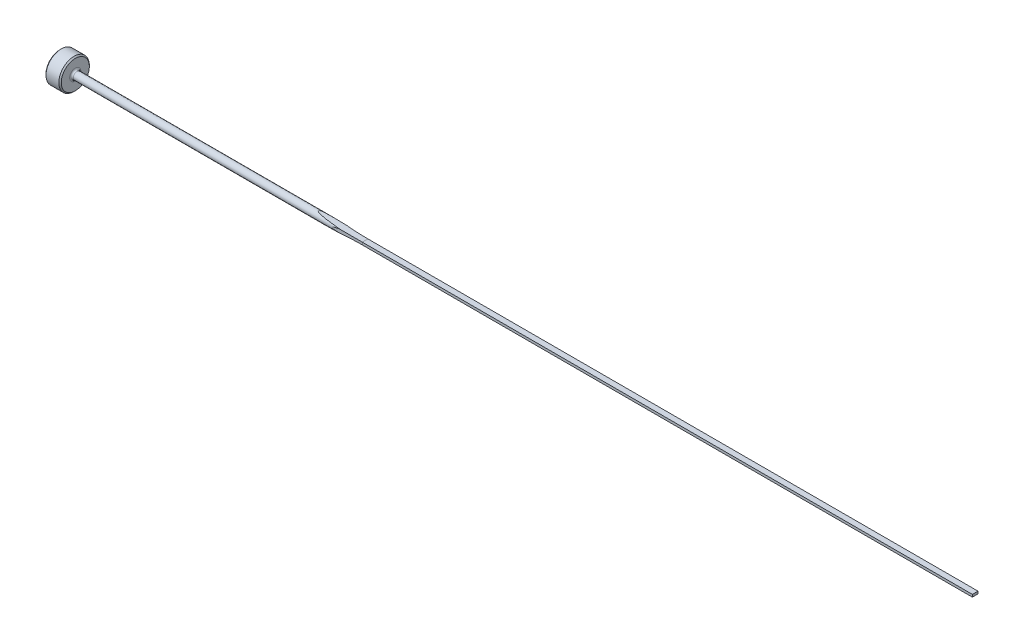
SolidWorks part; units mm, degrees
ref_plane "Front Plane" through (0, 0, 0) normal (0, 0, 1) x (1, 0, 0)
ref_plane "Top Plane" through (0, 0, 0) normal (0, 1, 0) x (1, 0, 0)
ref_plane "Right Plane" through (0, 0, 0) normal (1, 0, 0) x (0, 0, -1)
sketch "Sketch1" plane through (0, 0, 0) normal (0, 0, 1) x (1, 0, 0)
  line L0 (0, 0) -> (167.7268, 0) construction
  line L1 (0, 0) -> (0, 3.175)
  line L2 (0, 3.175) -> (3.175, 3.175)
  line L3 (3.175, 3.175) -> (3.175, 0.7938)
  line L4 (3.175, 0.7938) -> (190.5, 0.7937)
  line L5 (190.5, 0.7937) -> (190.5, 0)
  line L6 (190.5, 0) -> (0, 0)
  dimension "D1" = 190.5
  dimension "D2" = 6.35
  dimension "D3" = 1.5875
  dimension "D4" = 3.175
revolve "Revolve1" add sketch "Sketch1" angle 360 about L0
sketch "Sketch2" plane through (0, 0, 0) normal (0, 0, 1) x (1, 0, 0)
  line L0 (190.5, 0.7938) -> (190.5, 0.254)
  line L1 (190.5, -0.7937) -> (190.5, 0.7937) construction
  line L2 (190.5, 0.254) -> (63.5, 0.254)
  line L3 (190.5, 0.7938) -> (3.175, 0.7938) construction
  line L4 (53.7186, 0.7937) -> (190.5, 0.7938)
  line L5 (166.0833, 0) -> (153.1705, 0) construction
  arc A0 (63.5, 0.254) -> (53.7186, 0.7937) centre (63.5, 89.154) cw
  dimension "D1" = 88.9
  dimension "D3" = 127
  dimension "D2" = 0.508
  dimension "D4" = 9.7814
extrude "Cut-Extrude1" cut sketch "Sketch2" against normal through all both and the other way through all
mirror "Mirror1" about plane through (0, 0, 0) normal (0, 1, 0) of "Cut-Extrude1"
sketch "Sketch3" plane through (0, 0, 0) normal (0, 1, 0) x (1, 0, 0)
  line L0 (190.5, 0.7938) -> (190.5, 0.5842)
  line L1 (190.5, 0.752) -> (190.5, -0.752) construction
  line L2 (190.5, 0.5842) -> (63.5, 0.5842)
  line L3 (190.5, 0.7938) -> (3.175, 0.7938) construction
  line L4 (57.3997, 0.7937) -> (190.5, 0.7938)
  line L5 (163.4716, 0) -> (166.2513, 0) construction
  line L6 (63.5, 0.752) -> (63.5, -0.752) construction
  arc A0 (63.5, 0.5842) -> (57.3997, 0.7937) centre (63.5, 89.4842) cw
  dimension "D2" = 88.9
  dimension "D1" = 1.1684
extrude "Cut-Extrude2" cut sketch "Sketch3" against normal through all both and the other way through all
mirror "Mirror2" about plane through (0, 0, 0) normal (0, 0, 1) of "Cut-Extrude2"
fillet "Fillet1" radius 0.381 1 edges at (3.175, 0, 0.7938)
chamfer "Chamfer1" distance 0.254 angle 45 2 edges at (0, 0, 3.175) (3.175, 0, 3.175)
